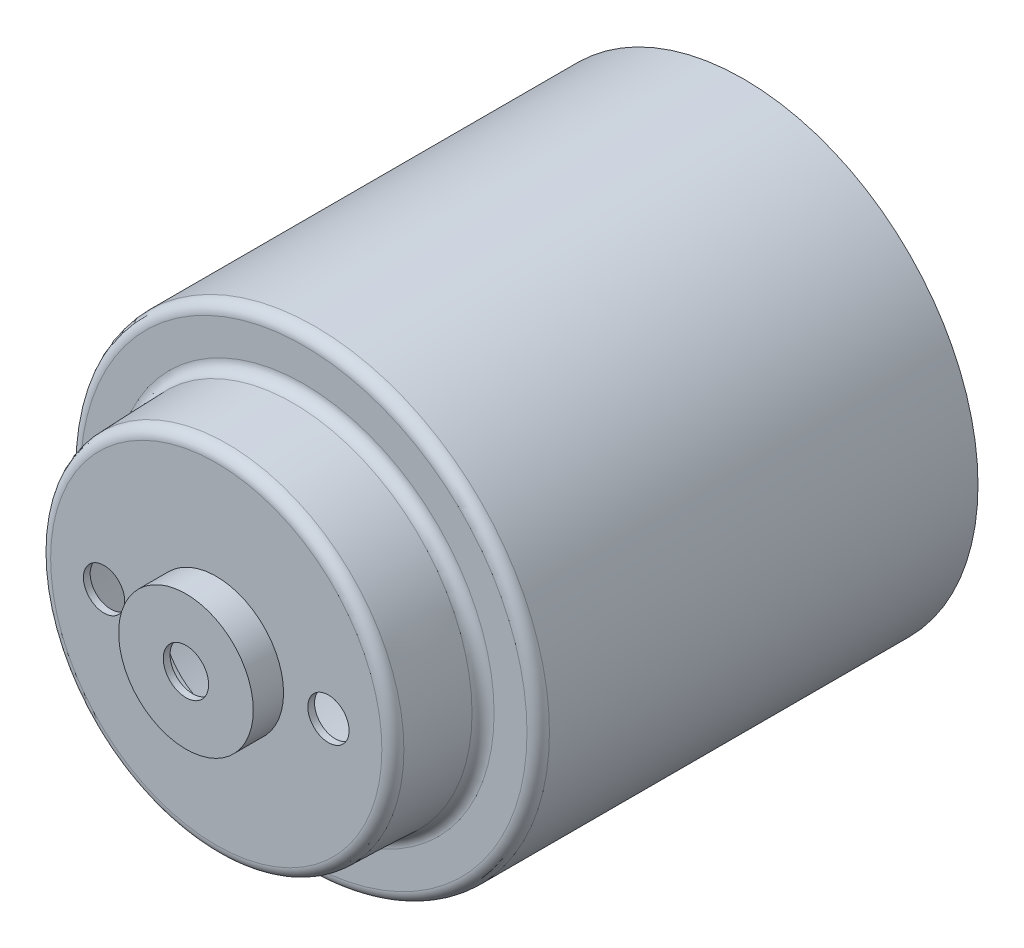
SolidWorks part; units mm, degrees
ref_plane "Face" through (0, 0, 0) normal (0, 0, 1) x (1, 0, 0)
ref_plane "Dessus" through (0, 0, 0) normal (0, 1, 0) x (1, 0, 0)
ref_plane "Droite" through (0, 0, 0) normal (1, 0, 0) x (0, 0, -1)
sketch "Esquisse1" plane through (0, 0, 0) normal (0, 0, 1) x (1, 0, 0)
  circle A0 centre (0, 0) radius 10.45
extrude "Base-Extrusion" add sketch "Esquisse1" along normal blind 19.6
sketch "Esquisse2" plane through (0, 0, 19.6) normal (0, 0, 1) x (1, 0, 0)
  circle A0 centre (0, 0) radius 8
extrude "Boss.-Extru.1" add sketch "Esquisse2" along normal blind 3.9
sketch "Esquisse3" plane through (0, 0, 23.5) normal (0, 0, 1) x (1, 0, 0)
  circle A0 centre (0, 0) radius 3
extrude "Boss.-Extru.2" add sketch "Esquisse3" along normal blind 1.35
draft "Dépouille1" type of draft neutral plane draft angle 2 faces to draft 1 parameters "D1"=2
fillet "Congé1" radius 0.5
fillet "Congé2" radius 0.5
fillet "Congé3" radius 0.5
shell "Coque1" thickness 0.3
sketch "Esquisse4" plane through (0, 0, 24.85) normal (0, 0, 1) x (1, 0, 0)
  line L0 (-12.639, 0) -> (12.8025, 0) construction
  line L1 (-5, 4.4637) -> (-5, -3.7443) construction
  line L2 (5, 4.6926) -> (5, -2.7632) construction
  line L3 (0, 5.4774) -> (0, -7.0471) construction
  circle A0 centre (0, 0) radius 1.01
  circle A1 centre (-5, 0) radius 0.92
  circle A2 centre (5, 0) radius 0.92
extrude "Enlèv. mat.-Extru.1" cut sketch "Esquisse4" against normal through all
